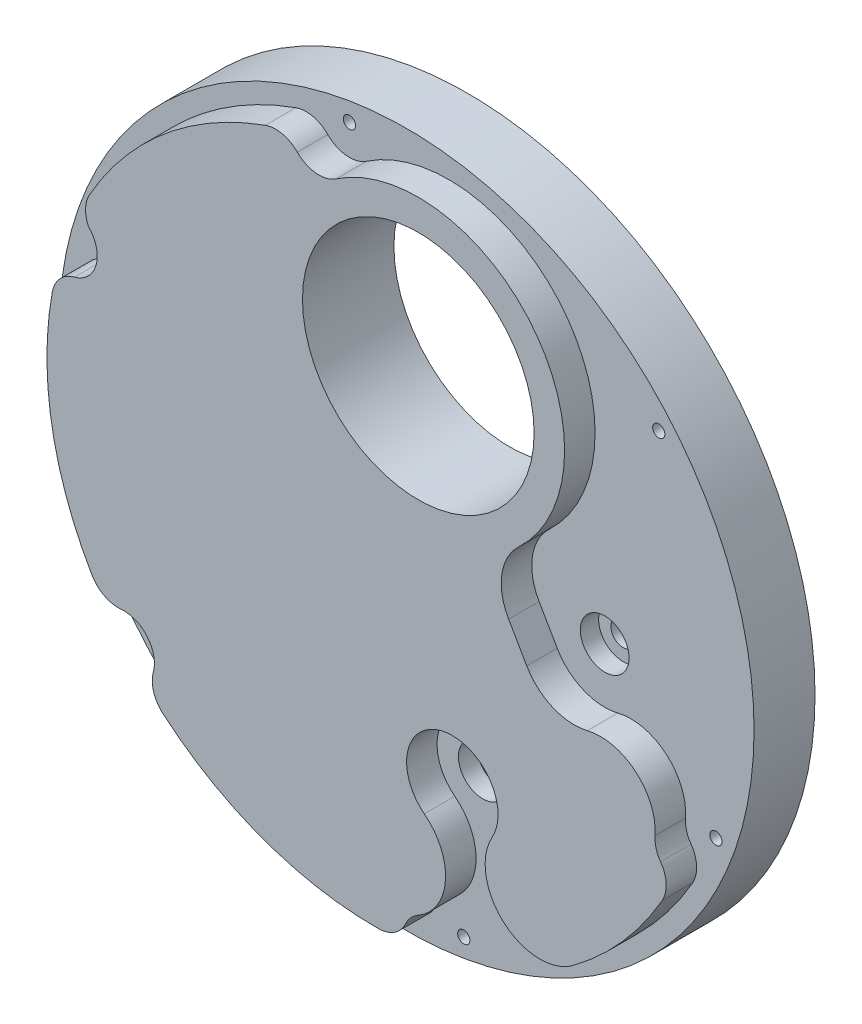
SolidWorks part; units mm, degrees
ref_plane "Plan de face" through (0, 0, 0) normal (0, 0, 1) x (1, 0, 0)
ref_plane "Plan de dessus" through (0, 0, 0) normal (0, 1, 0) x (1, 0, 0)
ref_plane "Plan de droite" through (0, 0, 0) normal (1, 0, 0) x (0, 0, -1)
sketch "Esquisse1" plane through (0, 0, 0) normal (0, 0, 1) x (1, 0, 0)
  circle A0 centre (0, 0) radius 57
  point P3 (-124.6996, 80.577)
  dimension "D1" = 114
extrude "Boss.-Extru.1" add sketch "Esquisse1" along normal blind 10
sketch "Esquisse2" plane through (0, 0, 10) normal (0, 0, 1) x (1, 0, 0)
  line L0 (0, 0) -> (0, 57) construction
  line L1 (0, 0) -> (-10.7203, 60.7981) construction
  line L3 (0, 0) -> (-70.4295, 25.6342) construction
  line L4 (0, 0) -> (-49.7668, -41.7593) construction
  line L5 (0, 0) -> (11.0059, -62.4177) construction
  line L6 (0, 0) -> (59.2861, -21.5784) construction
  line L7 (0, 0) -> (53.266, 44.6955) construction
  circle A0 centre (0, 0) radius 57 construction
  circle A1 centre (0, 0) radius 54 construction
  circle A2 centre (-50.7434, 18.4691) radius 1
  circle A3 centre (-9.377, 53.1796) radius 1
  circle A4 centre (-41.3664, -34.7105) radius 1
  circle A5 centre (9.377, -53.1796) radius 1
  circle A6 centre (50.7434, -18.4691) radius 1
  circle A7 centre (41.3664, 34.7105) radius 1
  dimension "D1" = 108
  dimension "D3" = 2
  dimension "D2" = 10
  dimension "D4" = 60
  dimension "D5" = 60
  dimension "D6" = 60
  dimension "D7" = 60
  dimension "D8" = 60
extrude "Enlèv. mat.-Extru.1" cut sketch "Esquisse2" against normal through all
sketch "Esquisse5" plane through (0, 0, 10) normal (0, 0, 1) x (1, 0, 0)
  line L0 (21.7317, 0.6512) -> (24.7058, -4.5)
  line L1 (0, 0) -> (0, -34.7105) construction
  line L2 (0, 0) -> (133.1233, 0) construction
  arc A0 (-34.9571, -41.1583) -> (0.3226, -53.999) centre (0, 0) ccw
  arc A1 (-47.0198, 26.5544) -> (-47.2079, 22.0046) centre (-42.6661, 24.0957) ccw
  arc A2 (-47.2079, 22.0046) -> (-49.4736, 13.633) centre (-50.7434, 18.4691) cw
  arc A3 (-49.4736, 13.633) -> (-53.1226, 9.6946) centre (-48.2039, 8.7969) ccw
  arc A4 (-46.6032, -27.2789) -> (-41.8273, -29.7318) centre (-42.2881, -24.7531) ccw
  arc A5 (-41.8273, -29.7318) -> (-36.5433, -36.0289) centre (-41.3664, -34.7105) cw
  arc A6 (-36.5433, -36.0289) -> (-34.9571, -41.1583) centre (-31.7203, -37.3473) ccw
  circle A7 centre (-50.7434, 18.4691) radius 1 construction
  circle A8 centre (-41.3664, -34.7105) radius 1 construction
  arc A9 (-53.1226, 9.6946) -> (-46.6032, -27.2789) centre (0, 0) ccw
  arc A10 (-18.1656, 50.8528) -> (-12.9303, 49.6619) centre (-16.4836, 46.1442) cw
  arc A11 (-12.9303, 49.6619) -> (-6.5674, 49.0437) centre (-9.377, 53.1796) ccw
  arc A12 (-6.5674, 49.0437) -> (23.3604, 11.7076) centre (6.9189, 29.1912) cw
  circle A13 centre (-9.377, 53.1796) radius 1 construction
  arc A14 (23.3604, 11.7076) -> (21.7317, 0.6512) centre (29.5259, 5.1512) ccw
  arc A15 (24.7058, -4.5) -> (34.639, -8.7421) centre (32.5, 0) ccw
  arc A16 (34.639, -8.7421) -> (45.7558, -18.1173) centre (36.7781, -17.4842) cw
  arc A17 (45.7558, -18.1173) -> (46.6621, -21.3576) centre (50.7434, -18.4691) ccw
  arc A18 (46.6621, -21.3576) -> (46.9259, -26.7201) centre (42.5809, -24.246) cw
  arc A19 (-18.1656, 50.8528) -> (-47.0198, 26.5544) centre (0, 0) ccw
  circle A20 centre (50.7434, -18.4691) radius 1 construction
  arc A21 (32.2576, -43.3064) -> (19.037, -31.6767) centre (26.8813, -36.0887) cw
  arc A22 (19.037, -31.6767) -> (7.9072, -33.9293) centre (12.5, -28) ccw
  arc A23 (7.9072, -33.9293) -> (6.8837, -48.8456) centre (2.3959, -41.0444) cw
  arc A24 (6.8837, -48.8456) -> (4.8349, -51.0894) centre (9.377, -53.1796) ccw
  arc A25 (4.8349, -51.0894) -> (0.3226, -53.999) centre (0.2928, -48.9991) cw
  circle A26 centre (9.377, -53.1796) radius 1 construction
  arc A27 (32.2576, -43.3064) -> (46.9259, -26.7201) centre (0, 0) ccw
  dimension "D1" = 108
  dimension "D2" = 5
  dimension "D3" = 5
  dimension "D4" = 5
  dimension "D5" = 5
  dimension "D6" = 5
  dimension "D7" = 5
  dimension "D8" = 24
  dimension "D9" = 5
  dimension "D10" = 5
  dimension "D12" = 9
  dimension "D13" = 9
  dimension "D14" = 9
  dimension "D16" = 5
  dimension "D17" = 5
  dimension "D18" = 5
  dimension "D19" = 5
  dimension "D20" = 9
  dimension "D21" = 9
  dimension "D22" = 12.5
  dimension "D24" = 15
  dimension "D11" = 30
  dimension "D15" = 32.5
  dimension "D23" = 28
extrude "Boss.-Extru.2" add sketch "Esquisse5" along normal blind 5
sketch "Esquisse6" plane through (0, 0, 15) normal (0, 0, 1) x (1, 0, 0)
  circle A0 centre (6.9189, 29.1912) radius 19
  circle A1 centre (32.5, 0) radius 2
  circle A2 centre (12.5, -28) radius 2
  arc A3 (24.7058, -4.5) -> (34.639, -8.7421) centre (32.5, 0) ccw construction
  dimension "D1" = 38
  dimension "D2" = 4
  dimension "D3" = 4
extrude "Enlèv. mat.-Extru.2" cut sketch "Esquisse6" against normal through all
sketch "Esquisse7" plane through (0, 0, 10) normal (0, 0, 1) x (1, 0, 0)
  circle A0 centre (32.5, 0) radius 4
  circle A2 centre (12.5, -28) radius 4
  circle A3 centre (12.5, -28) radius 2 construction
  circle A4 centre (32.5, 0) radius 2 construction
  dimension "D1" = 8
  dimension "D2" = 8
extrude "Enlèv. mat.-Extru.3" cut sketch "Esquisse7" against normal blind 3
